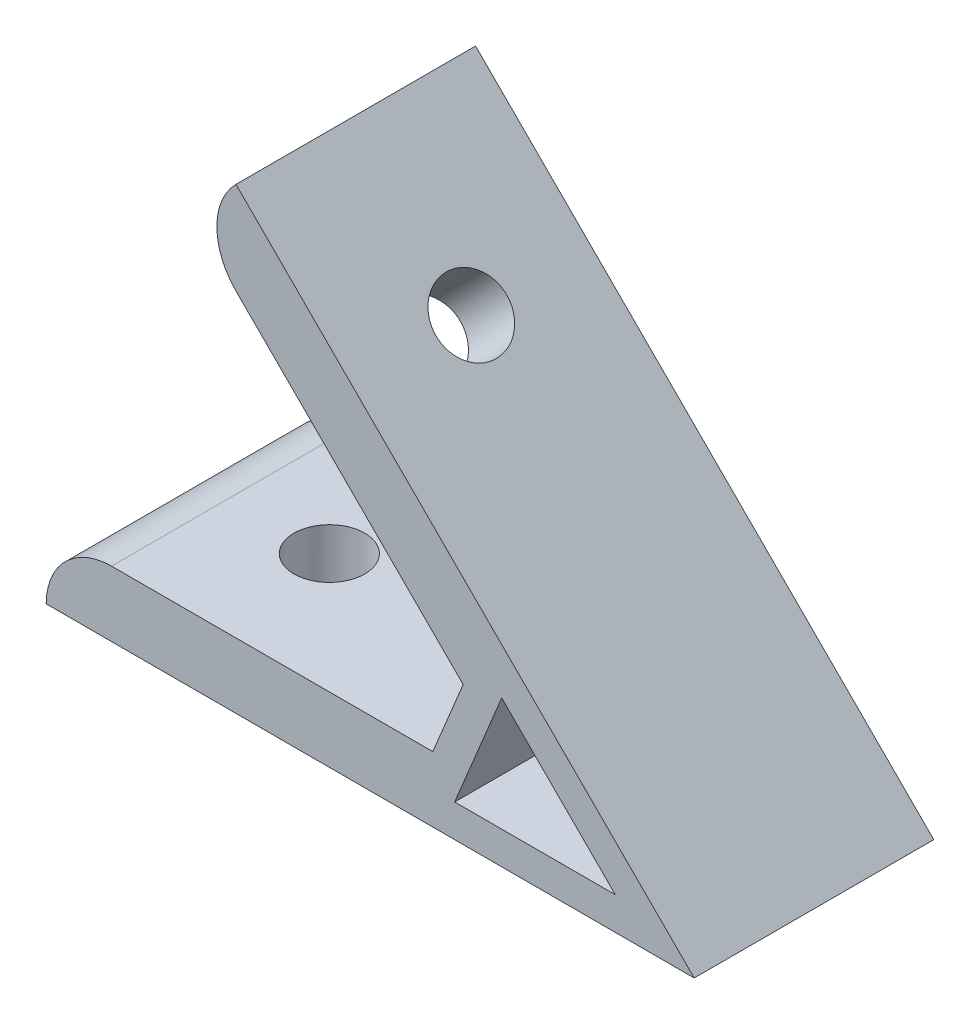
SolidWorks part; units mm, degrees
ref_plane "前视基准面" through (0, 0, 0) normal (0, 0, 1) x (1, 0, 0)
ref_plane "上视基准面" through (0, 0, 0) normal (0, 1, 0) x (1, 0, 0)
ref_plane "右视基准面" through (0, 0, 0) normal (1, 0, 0) x (0, 0, -1)
sketch "草图1" plane through (0, 0, 0) normal (0, 0, 1) x (1, 0, 0)
  line L0 (0, 0) -> (59.5, 0)
  line L1 (59.5, 0) -> (17.4271, 42.0729)
  line L2 (17.4271, 42.0729) -> (13.1845, 37.8302)
  line L3 (13.1845, 37.8302) -> (38.2868, 12.7279)
  line L4 (38.2868, 12.7279) -> (35.5, 6)
  line L5 (35.5, 6) -> (0, 6)
  line L6 (0, 6) -> (0, 0)
  dimension "D1" = 45
  dimension "D2" = 59.5
  dimension "D3" = 59.5
  dimension "D4" = 6
  dimension "D5" = 6
  dimension "D6" = 35.5
  dimension "D7" = 35.5
  dimension "D8" = 7.2823
extrude "凸台-拉伸1" add sketch "草图1" along normal mid plane 22
sketch "草图2" plane through (0, 0, 11) normal (0, 0, 1) x (1, 0, 0)
  line L0 (41.8255, 13.4318) -> (37.5045, 3)
  line L1 (41.8255, 13.4318) -> (52.2574, 3)
  line L2 (52.2574, 3) -> (37.5045, 3)
  line L4 (0, 0) -> (59.5, 0) construction
  line L5 (59.5, 0) -> (17.4271, 42.0729) construction
  line L7 (38.2868, 12.7279) -> (35.5, 6) construction
  dimension "D1" = 45
  dimension "D2" = 45
  dimension "D3" = 3
  dimension "D4" = 3
  dimension "D5" = 67.5
  dimension "D6" = 67.5
  dimension "D7" = 3
  dimension "D8" = 3
extrude "切除-拉伸1" cut sketch "草图2" against normal through all
fillet "圆角1" radius 6 1 edges at (13.1845, 37.8302, 0)
fillet "圆角2" radius 6 1 edges at (0, 6, 0)
sketch "草图3" plane through (29.75, 29.75, 0) normal (0.7071, 0.7071, 0) x (0, 0, -1)
  line L0 (-11, 17.4271) -> (11, 17.4271) construction
  line L3 (11, -42.0729) -> (11, 17.4271) construction
  circle A0 centre (0, 2.4271) radius 3.25
  dimension "D1" = 11
  dimension "D3" = 6.5
  dimension "D2" = 15
extrude "切除-拉伸2" cut sketch "草图3" against normal blind 32
ref_plane "基准面1" through (8.7136, 21.0364, 0) normal (0.3827, 0.9239, 0) x (-0.9239, 0.3827, 0)
mirror "镜向1" about plane through (8.7136, 21.0364, 0) normal (0.3827, 0.9239, 0) of "切除-拉伸2"
